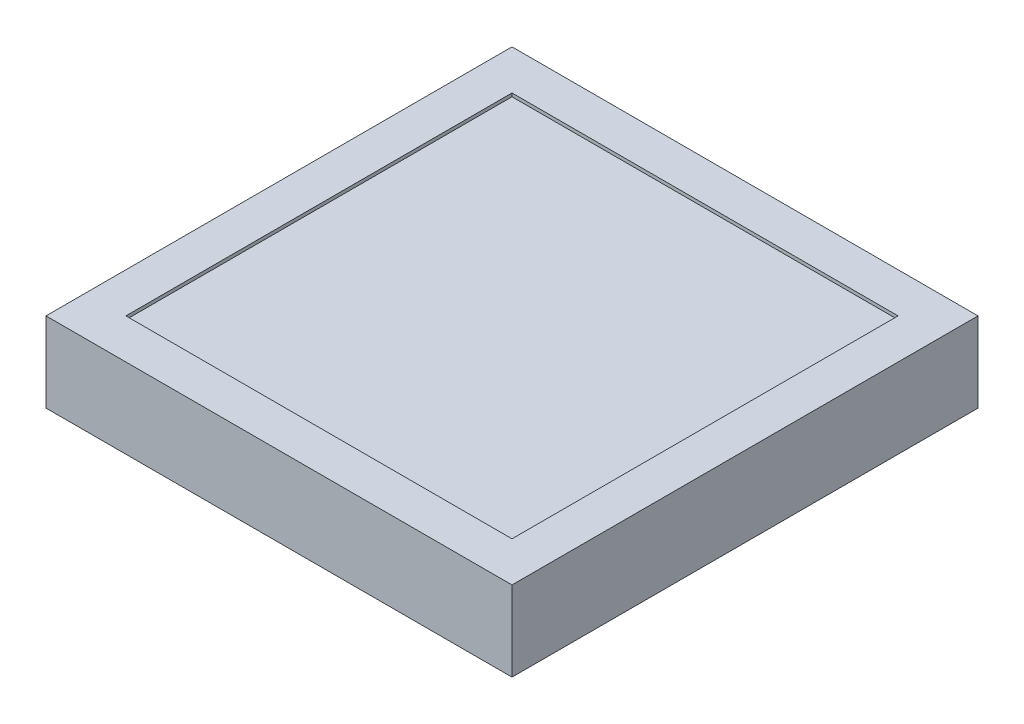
SolidWorks part; units mm, degrees
ref_plane "Alzado" through (0, 0, 0) normal (0, 0, 1) x (1, 0, 0)
ref_plane "Planta" through (0, 0, 0) normal (0, 1, 0) x (1, 0, 0)
ref_plane "Vista lateral" through (0, 0, 0) normal (1, 0, 0) x (0, 0, -1)
sketch "Croquis1" plane through (0, 0, 0) normal (0, 1, 0) x (1, 0, 0)
  line L1 (4.1435, -145.2549) -> (144.1435, -145.2549)
  line L2 (4.1435, -145.2549) -> (4.1435, -5.2549)
  line L3 (4.1435, -5.2549) -> (144.1435, -5.2549)
  line L4 (144.1435, -145.2549) -> (144.1435, -5.2549)
  line L5 (4.1435, -145.2549) -> (144.1435, -5.2549) construction
  line L6 (4.1435, -5.2549) -> (144.1435, -145.2549) construction
  dimension "D1" = 140
  dimension "D2" = 140
extrude "Saliente-Extruir1" add sketch "Croquis1" along normal blind 24
sketch "Croquis3" plane through (0, 24, 0) normal (0, 1, 0) x (1, 0, 0)
  line L0 (144.1435, -145.2549) -> (144.1435, -5.2549) construction
  line L1 (16.1435, -133.2549) -> (132.1435, -133.2549)
  line L2 (16.1435, -133.2549) -> (16.1435, -17.2549)
  line L3 (16.1435, -17.2549) -> (132.1435, -17.2549)
  line L4 (132.1435, -133.2549) -> (132.1435, -17.2549)
  line L5 (16.1435, -133.2549) -> (132.1435, -17.2549) construction
  line L6 (16.1435, -17.2549) -> (132.1435, -133.2549) construction
  line L7 (144.1435, -5.2549) -> (4.1435, -5.2549) construction
  line L8 (4.1435, -5.2549) -> (4.1435, -145.2549) construction
  line L9 (4.1435, -145.2549) -> (144.1435, -145.2549) construction
  point P0 (74.1435, -75.2549)
  dimension "D1" = 12
  dimension "D2" = 12
  dimension "D3" = 12
  dimension "D4" = 12
extrude "Cortar-Extruir2" cut sketch "Croquis3" against normal blind 1
